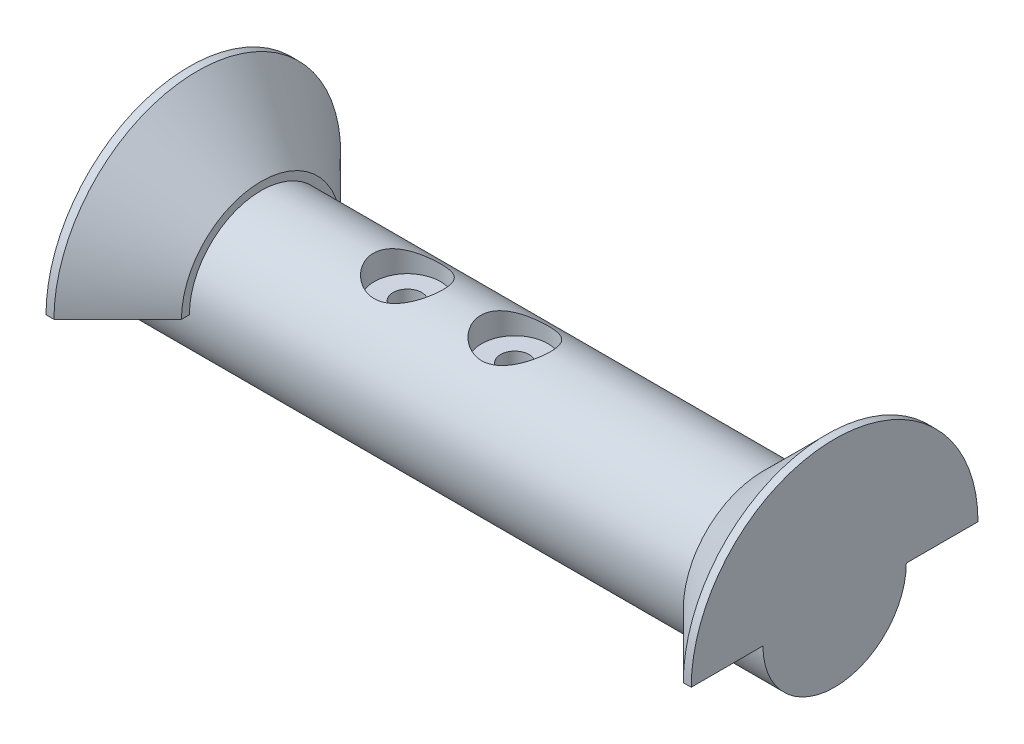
SolidWorks part; units mm, degrees
ref_plane "Front Plane" through (0, 0, 0) normal (0, 0, 1) x (1, 0, 0)
ref_plane "Top Plane" through (0, 0, 0) normal (0, 1, 0) x (1, 0, 0)
ref_plane "Right Plane" through (0, 0, 0) normal (1, 0, 0) x (0, 0, -1)
sketch "Sketch1" plane through (0, 0, 0) normal (1, 0, 0) x (0, 0, -1)
  circle A0 centre (0, 0) radius 10
  dimension "D1" = 20
extrude "Boss-Extrude1" add sketch "Sketch1" against normal blind 45
sketch "Sketch2" plane through (-45, 0, 0) normal (-1, 0, 0) x (0, 0, 1)
  line L0 (-20, 0) -> (20, 0)
  arc A1 (20, 0) -> (-20, 0) centre (0, 0) ccw
  dimension "D1" = 20
extrude "Boss-Extrude2" add sketch "Sketch2" against normal blind 10
mirror "Mirror1" about plane through (0, 0, 0) normal (1, 0, 0) of "Boss-Extrude1", "Boss-Extrude2"
chamfer "Chamfer2" distance 8.89 angle 45 1 edges at (-35, 20, 0)
chamfer "Chamfer3" distance 8.89 angle 45 1 edges at (35, 20, 0)
sketch "Sketch3" plane through (-45, 0, 0) normal (-1, 0, 0) x (0, 0, 1)
  line L1 (-7.5, -20) -> (7.5, -20)
  line L2 (-7.5, -20) -> (-7.5, 0)
  line L3 (-7.5, 0) -> (7.5, 0)
  line L4 (7.5, -20) -> (7.5, 0)
  line L5 (-7.5, -20) -> (7.5, 0) construction
  line L6 (-7.5, 0) -> (7.5, -20) construction
  arc A0 (-10, 0) -> (10, 0) centre (0, 0) ccw construction
  point P0 (0, -10)
  dimension "D1" = 15
  dimension "D2" = 20
extrude "Cut-Extrude1" cut sketch "Sketch3" against normal blind 88.36
sketch "Sketch7" plane through (0, 0, 0) normal (0, -1, 0) x (1, 0, 0)
  line L2 (-45, 10) -> (-45, 20) construction
  circle A0 centre (0, -0.3971) radius 4.75
  circle A1 centre (-14.986, -0.3971) radius 4.75
  dimension "D1" = 9.5
  dimension "D2" = 2
  dimension "D3" = 45
extrude "Boss-Extrude4" add sketch "Sketch7" along normal blind 2
sketch "Sketch5" plane through (0, -2, 0) normal (0, -1, 0) x (1, 0, 0)
  circle A0 centre (0, -0.3971) radius 2
  circle A1 centre (-14.986, -0.3971) radius 2
  dimension "D1" = 2
  dimension "4mm" = 4
extrude "Cut-Extrude2" cut sketch "Sketch5" against normal through all
ref_plane "Plane1" through (0, 10, 0) normal (0, -1, 0) x (-1, 0, 0)
sketch "Sketch6" plane through (0, 10, 0) normal (0, -1, 0) x (-1, 0, 0)
  circle A0 centre (14.986, 0.3971) radius 4.625
  circle A1 centre (0, 0.3971) radius 4.625
  dimension "D1" = 9.25
  dimension "D2" = 2
extrude "Cut-Extrude3" cut sketch "Sketch6" along normal blind 3.5
chamfer "Chamfer4" distance 2.54 angle 45 2 edges at (0, 0, 4.3529) (-14.986, 0, 4.3529)
